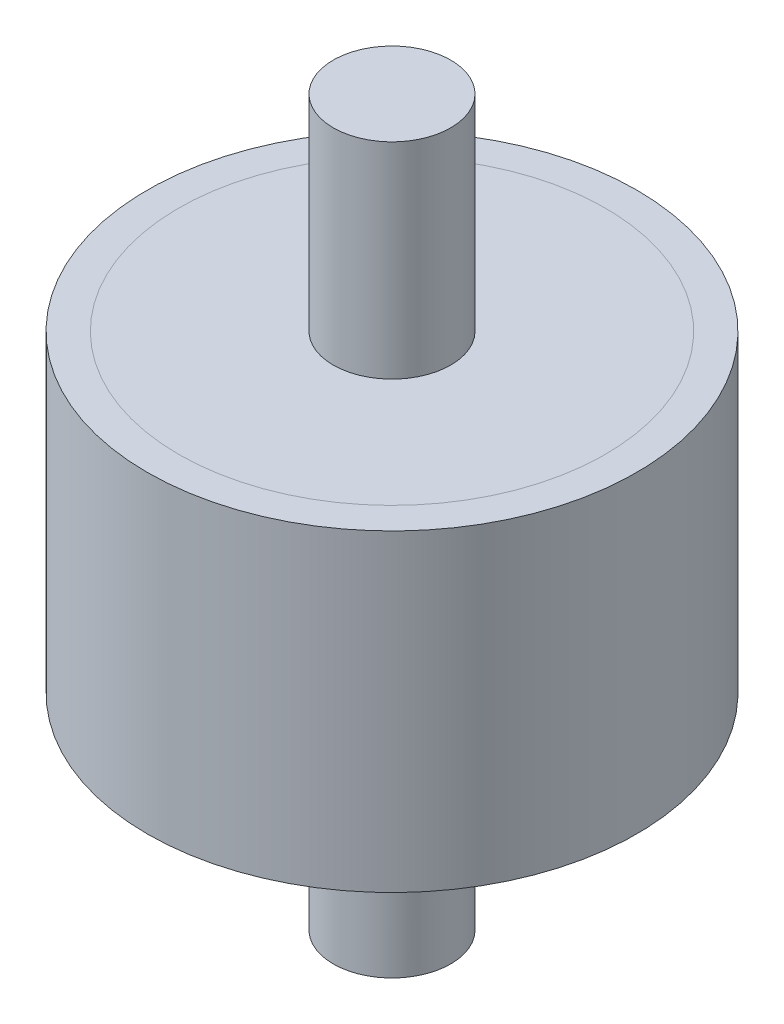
SolidWorks part; units mm, degrees
ref_plane "Front" through (0, 0, 0) normal (0, 0, 1) x (1, 0, 0)
ref_plane "Top" through (0, 0, 0) normal (0, 1, 0) x (1, 0, 0)
ref_plane "Right" through (0, 0, 0) normal (1, 0, 0) x (0, 0, -1)
sketch "Sketch2" plane through (0, 0, 0) normal (0, 0, 1) x (1, 0, 0)
  line L0 (0, 83.5243) -> (0, -77.8223) construction
  line L1 (-19.8437, 12.7) -> (0, 12.7)
  line L2 (-19.8437, 12.7) -> (-19.8437, -12.7)
  line L3 (-19.8437, -12.7) -> (0, -12.7)
  line L4 (0, 12.7) -> (0, -12.7)
  dimension "D1" = 39.6875
  dimension "D2" = 25.4
revolve "Revolve1" add sketch "Sketch2" angle 360 about L0
sketch "Sketch4" plane through (0, 12.7, 0) normal (0, 1, 0) x (-1, 0, 0)
  circle A2 centre (0, 0) radius 17.3037
  circle A3 centre (0, 0) radius 17.3038
  dimension "D1" = 2.54
sketch "Sketch5" plane through (0, -12.7, 0) normal (0, -1, 0) x (1, 0, 0)
  circle A2 centre (0, 0) radius 17.3037
  circle A3 centre (0, 0) radius 17.3038
  dimension "D1" = 2.54
sketch "Sketch6" plane through (0, 0, 0) normal (0, 0, 1) x (1, 0, 0)
  line L0 (0, 26.3094) -> (0, -27.1979) construction
  line L1 (-30.4557, 0) -> (36.2803, 0) construction
  line L2 (0, 12.7) -> (-4.7625, 12.7)
  line L3 (0, 12.7) -> (0, 29.3688)
  line L4 (0, 29.3688) -> (-4.7625, 29.3688)
  line L5 (-4.7625, 12.7) -> (-4.7625, 29.3688)
  line L6 (-4.7625, -12.7) -> (-4.7625, -29.3688)
  line L7 (0, -29.3688) -> (-4.7625, -29.3688)
  line L8 (0, -12.7) -> (0, -29.3688)
  line L9 (0, -12.7) -> (-4.7625, -12.7)
  line L10 (19.8437, 12.7) -> (-19.8437, 12.7) construction
  dimension "D1" = 16.6687
  dimension "D2" = 9.525
revolve "Revolve2" add sketch "Sketch6" angle 360 about L0
